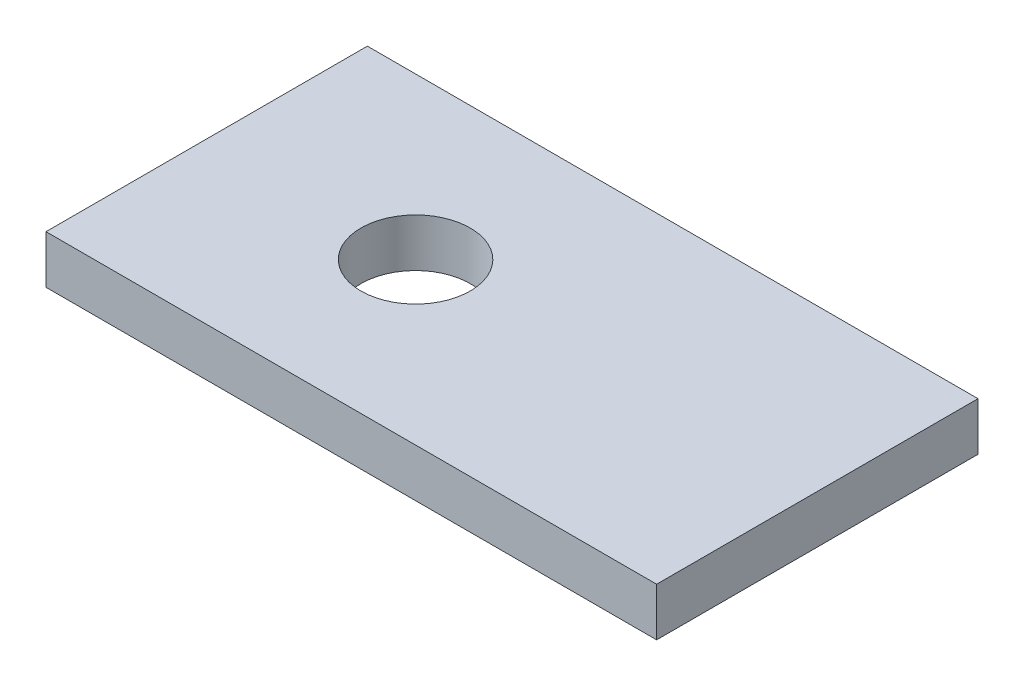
SolidWorks part; units mm, degrees
ref_plane "Front Plane" through (0, 0, 0) normal (0, 0, 1) x (1, 0, 0)
ref_plane "Top Plane" through (0, 0, 0) normal (0, 1, 0) x (1, 0, 0)
ref_plane "Right Plane" through (0, 0, 0) normal (1, 0, 0) x (0, 0, -1)
sketch "Sketch1" plane through (0, 0, 0) normal (0, 1, 0) x (1, 0, 0)
  line L1 (0, 0) -> (38, 0)
  line L2 (0, 0) -> (0, 20)
  line L3 (0, 20) -> (38, 20)
  line L4 (38, 0) -> (38, 20)
  dimension "D1" = 38
  dimension "D2" = 20
extrude "Extrude1" add sketch "Sketch1" along normal blind 3
sketch "Sketch2" plane through (0, 3, 0) normal (0, 1, 0) x (1, 0, 0)
  line L0 (0, 20) -> (0, 0) construction
  line L1 (0, 0) -> (38, 0) construction
  point P0 (13, 10)
  point P1 (0, 10)
  dimension "D1" = 13
  dimension "D2" = 10
hole_wizard "M8 Tapped Hole1" positions "3DSketch1" profile "Sketch3" tap size "M8" standard "ISO"
sketch3d "3DSketch1"
  point P0 (13, 3, -10)
sketch "Sketch3" plane through (13, 3, -10) normal (1, 0, 0) x (0, 0, 1)
  line L0 (0, 0) -> (0, 3)
  line L1 (0, 3) -> (3.4, 3)
  line L2 (3.4, 3) -> (3.4, 0)
  line L5 (3.4, 0) -> (0, 0)
  line L11 (0, -6.35) -> (0, 107.95) construction
  dimension "Thru Tap Drill Dia." = 6.8
  dimension "Thru Tap Drill Depth" = 3
